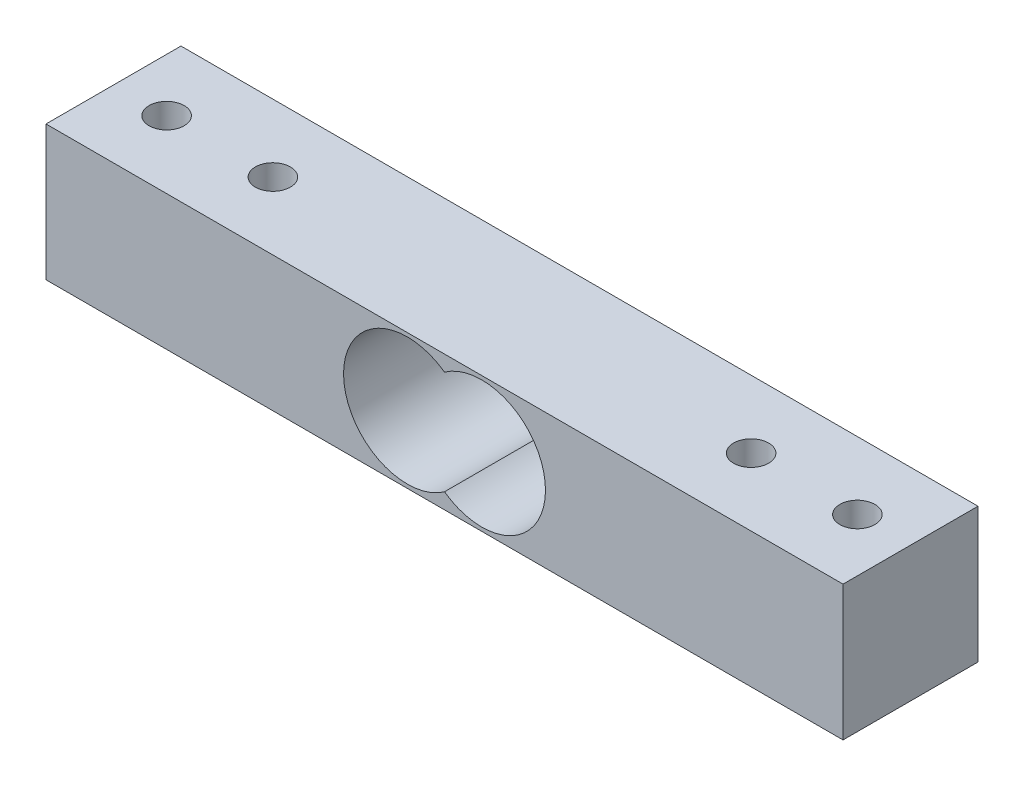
SolidWorks part; units mm, degrees
ref_plane "前视基准面" through (0, 0, 0) normal (0, 0, 1) x (1, 0, 0)
ref_plane "上视基准面" through (0, 0, 0) normal (0, 1, 0) x (1, 0, 0)
ref_plane "右视基准面" through (0, 0, 0) normal (1, 0, 0) x (0, 0, -1)
other "Configuration Table"
sketch "草图1" plane through (0, 0, 0) normal (0, 1, 0) x (1, 0, 0)
  line L0 (0, 0) -> (38.0456, 0) construction
  line L1 (0, 0) -> (0, 19.0554) construction
  line L3 (-37.5, 6.35) -> (37.5, 6.35)
  line L4 (-37.5, 6.35) -> (-37.5, -6.35)
  line L5 (-37.5, -6.35) -> (37.5, -6.35)
  line L6 (37.5, 6.35) -> (37.5, -6.35)
  line L7 (-37.5, 6.35) -> (37.5, -6.35) construction
  line L8 (-37.5, -6.35) -> (37.5, 6.35) construction
  point P1 (0, 0)
  dimension "D1" = 75
  dimension "D2" = 12.7
extrude "凸台-拉伸1" add sketch "草图1" against normal blind 12.7 contours L4 L5 L6 L3
sketch "草图14" plane through (0, 0, -6.35) normal (0, 0, -1) x (-1, 0, 0)
  line L0 (0, 0) -> (0, -22.4555) construction
  line L2 (0, 0) -> (46.0049, 0) construction
  line L3 (-1019, -6.35) -> (-9.5, -6.35) construction
  line L4 (9.5, -6.35) -> (1013.4872, -6.35) construction
  arc A0 (0, -1.4766) -> (0, -11.2234) centre (-3.5, -6.35) ccw
  arc A1 (0, -11.2234) -> (0, -1.4766) centre (3.5, -6.35) ccw
  dimension "D4" = 12
  dimension "D5" = 12
  dimension "D1" = 6.35
  dimension "D2" = 7
  dimension "D3" = 3.5
extrude "切除-拉伸1" cut sketch "草图14" against normal through all
hole_wizard "M4 螺纹孔1" positions "草图16" profile "草图17" tap size "M4" standard "GB"
sketch "草图16" plane through (0, 0, 0) normal (0, 1, 0) x (1, 0, 0)
  line L0 (-37.5, 6.35) -> (-37.5, -6.35) construction
  line L1 (37.5, 6.35) -> (37.5, -6.35) construction
  line L2 (-37.5, 6.35) -> (37.5, 6.35) construction
  point P0 (-32.5, 0)
  point P2 (-22.5, 0)
  point P4 (22.5, 0)
  point P6 (32.5, 0)
  dimension "D1" = 5
  dimension "D2" = 10
  dimension "D3" = 5
  dimension "D4" = 10
  dimension "D5" = 6.35
  dimension "D6" = 6.35
  dimension "D7" = 6.35
  dimension "D8" = 6.35
sketch "草图17" plane through (-32.5, 0, 0) normal (1, 0, 0) x (0, 0, 1)
  line L0 (0, 0) -> (0, 12.7)
  line L1 (0, 12.7) -> (1.65, 12.7)
  line L2 (1.65, 12.7) -> (1.65, 0)
  line L5 (1.65, 0) -> (0, 0)
  line L11 (0, -6.35) -> (0, 107.95) construction
  dimension "通孔螺纹孔钻头直径" = 3.3
  dimension "通孔螺纹孔钻头深度" = 12.7
